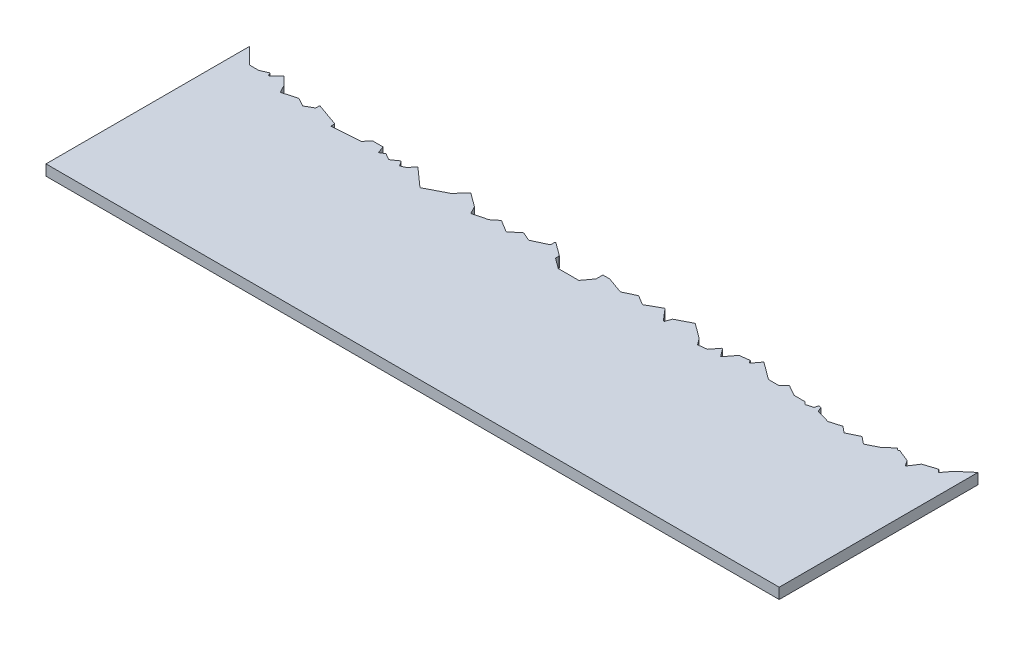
SolidWorks part; units mm, degrees
ref_plane "Plan de face" through (0, 0, 0) normal (0, 0, 1) x (1, 0, 0)
ref_plane "Plan de dessus" through (0, 0, 0) normal (0, 1, 0) x (1, 0, 0)
ref_plane "Plan de droite" through (0, 0, 0) normal (1, 0, 0) x (0, 0, -1)
sketch "Esquisse1" plane through (0, 0, 0) normal (0, 1, 0) x (1, 0, 0)
  line L0 (0, 380) -> (29.6078, 350.3922)
  line L1 (0, 0) -> (1380, 0)
  line L2 (0, 0) -> (0, 380)
  line L3 (30.3859, 350.0699) -> (47.204, 350.0699)
  line L4 (1380, 0) -> (1380, 380)
  line L5 (66.2029, 351.1725) -> (79.2872, 364.2568)
  line L6 (80.8434, 364.2568) -> (94.909, 350.1913)
  line L7 (95.109, 349.9173) -> (102.5748, 335.4306)
  line L8 (287.6719, 341.6175) -> (291.7608, 330.0833)
  line L9 (293.345, 329.4961) -> (300.7253, 333.7234)
  line L10 (161.514, 342.9881) -> (161.514, 348.511)
  line L11 (162.9829, 349.548) -> (204.2333, 334.8908)
  line L12 (204.9653, 333.8538) -> (204.9653, 328.0946)
  line L13 (206.1457, 326.997) -> (257.5216, 330.7384)
  line L14 (258.2637, 331.1044) -> (267.9444, 341.9814)
  line L15 (268.7664, 342.3503) -> (286.6347, 342.3503)
  line L16 (301.8089, 333.7292) -> (312.938, 327.5128)
  line L17 (314.1003, 327.5683) -> (326.2066, 335.9349)
  line L18 (342.3749, 330.9438) -> (351.7952, 341.5283)
  line L19 (353.3489, 341.6187) -> (365.5372, 330.7709)
  line L20 (365.5372, 330.7709) -> (387.3192, 311.3846)
  line L21 (388.5549, 311.2284) -> (426.2933, 330.6771)
  line L22 (426.6112, 330.9237) -> (442.9839, 349.3197)
  line L23 (444.4595, 349.4734) -> (456.7225, 340.4204)
  line L24 (456.7225, 340.4204) -> (469.5866, 330.9236)
  line L25 (469.9112, 330.5423) -> (476.7932, 317.1884)
  line L26 (744.2508, 329.6216) -> (766.414, 340.1649)
  line L27 (767.4591, 340.111) -> (784.4559, 329.7602)
  line L28 (785.5663, 329.7402) -> (811.2963, 344.1599)
  line L29 (812.6729, 343.9125) -> (824.9822, 329.4257)
  line L30 (602.2947, 341.1208) -> (602.2947, 347.8897)
  line L31 (604.0488, 348.775) -> (627.9897, 331.1008)
  line L32 (628.4366, 330.2154) -> (628.4366, 324.1417)
  line L33 (628.8834, 323.2564) -> (647.6092, 309.4322)
  line L34 (648.2628, 309.2171) -> (685.8402, 309.2171)
  line L35 (686.7256, 309.6639) -> (699.7849, 327.3537)
  line L36 (700, 328.0073) -> (700, 339.3199)
  line L37 (701.1004, 340.4204) -> (712.7067, 340.4204)
  line L38 (713.0752, 340.3569) -> (743.4096, 329.5784)
  line L39 (902.1623, 315.9772) -> (917.6508, 317.9743)
  line L40 (918.3813, 318.3935) -> (929.5593, 332.8809)
  line L41 (832.7537, 323.347) -> (836.4048, 333.6224)
  line L42 (836.9376, 334.2322) -> (863.9786, 348.1679)
  line L43 (865.1363, 348.075) -> (892.6776, 327.7428)
  line L44 (892.908, 327.5129) -> (901.1376, 316.4132)
  line L45 (1024.2055, 326.0327) -> (1043.2952, 326.0327)
  line L46 (1044.0733, 326.355) -> (1052.8484, 335.1301)
  line L47 (980.4641, 335.4146) -> (990.6296, 349.1846)
  line L48 (992.1686, 349.4163) -> (1013.0067, 334.0327)
  line L49 (1013.0067, 334.0327) -> (1023.5519, 326.2478)
  line L50 (1054.1696, 335.309) -> (1073.2496, 324.4831)
  line L51 (1073.7926, 324.3398) -> (1093.6981, 324.3398)
  line L53 (1121.8171, 321.1644) -> (1147.1468, 313.6935)
  line L54 (47.6431, 350.1613) -> (61.0963, 356.0161)
  line L55 (62.5293, 355.4794) -> (64.4309, 351.4783)
  line L56 (1147.7703, 313.6938) -> (1168.4316, 319.8059)
  line L57 (103.8529, 334.8759) -> (129.8044, 342.2261)
  line L58 (130.6409, 342.128) -> (145.5313, 333.8106)
  line L59 (1169.4352, 319.6067) -> (1180.3358, 310.8019)
  line L60 (1261.4801, 333.7148) -> (1284.1509, 324.5923)
  line L61 (1284.6558, 324.1816) -> (1290.7848, 314.9834)
  line L62 (1292.6193, 314.9879) -> (1303.7178, 331.8247)
  line L63 (1304.2987, 332.2663) -> (1327.5284, 339.7609)
  line L64 (1328.6968, 339.4355) -> (1332.4141, 335.1591)
  line L65 (1259.9808, 333.0723) -> (1260.184, 333.3474)
  line L68 (1334.13, 335.2275) -> (1345.0131, 349.9693)
  line L69 (1345.1822, 350.1512) -> (1380, 380)
  line L70 (146.6149, 333.8165) -> (160.9605, 342.0332)
  line L71 (327.7376, 335.6553) -> (333.2564, 327.6697)
  line L72 (334.6193, 327.2946) -> (342.0105, 330.6746)
  line L73 (478.054, 316.629) -> (504.0091, 323.5254)
  line L74 (504.4218, 323.736) -> (516.4467, 333.5366)
  line L75 (517.7225, 333.6184) -> (538.9932, 320.4083)
  line L76 (540.2691, 320.4901) -> (557.2893, 334.3622)
  line L77 (558.4326, 334.5143) -> (573.9539, 327.5964)
  line L78 (574.8677, 327.6046) -> (601.6601, 340.1238)
  line L79 (824.9822, 329.4257) -> (830.906, 322.9714)
  line L80 (931.3145, 332.864) -> (941.4444, 319.2013)
  line L81 (943.1996, 319.1845) -> (957.1005, 337.2008)
  line L82 (957.831, 337.62) -> (975.4217, 339.8882)
  line L83 (976.5262, 339.3278) -> (978.615, 335.5372)
  line L84 (1181.51, 310.669) -> (1202.7297, 321.0266)
  line L85 (1094.4763, 324.0175) -> (1098.2905, 320.2032)
  line L86 (1203.9039, 320.8937) -> (1216.3978, 310.8019)
  line L87 (1099.3808, 319.9261) -> (1111.17, 323.4136)
  line L88 (1111.9176, 324.1725) -> (1113.4005, 329.4764)
  line L89 (1114.7566, 330.2399) -> (1118.3693, 329.2299)
  line L90 (1119.1282, 328.4823) -> (1121.0731, 321.9078)
  line L91 (1217.572, 310.669) -> (1239.2738, 321.2619)
  line L92 (1239.5411, 321.4455) -> (1254.1736, 335.0719)
  line L93 (1255.6151, 335.1226) -> (1258.404, 332.8698)
  arc A0 (1345.0131, 349.9693) -> (1345.1822, 350.1512) centre (1345.8984, 349.3158) cw
  arc A1 (1332.4141, 335.1591) -> (1334.13, 335.2275) centre (1333.2447, 335.8811) ccw
  arc A2 (1327.5284, 339.7609) -> (1328.6968, 339.4355) centre (1327.8663, 338.7136) cw
  arc A3 (1303.7178, 331.8247) -> (1304.2987, 332.2663) centre (1304.6366, 331.219) cw
  arc A4 (1290.7848, 314.9834) -> (1292.6193, 314.9879) centre (1291.7006, 315.5936) ccw
  arc A5 (1284.1509, 324.5923) -> (1284.6558, 324.1816) centre (1283.7401, 323.5714) cw
  arc A6 (1260.184, 333.3474) -> (1261.4801, 333.7148) centre (1261.0693, 332.6939) cw
  arc A7 (1259.9808, 333.0723) -> (1258.404, 332.8698) centre (1259.0955, 333.7259) cw
  arc A8 (1254.1736, 335.0719) -> (1255.6151, 335.1226) centre (1254.9236, 334.2665) cw
  arc A9 (1239.2738, 321.2619) -> (1239.5411, 321.4455) centre (1238.7911, 322.2508) ccw
  arc A10 (1216.3978, 310.8019) -> (1217.572, 310.669) centre (1217.0893, 311.6579) ccw
  arc A11 (1202.7297, 321.0266) -> (1203.9039, 320.8937) centre (1203.2124, 320.0377) cw
  arc A12 (1180.3358, 310.8019) -> (1181.51, 310.669) centre (1181.0272, 311.6579) ccw
  arc A13 (1169.4352, 319.6067) -> (1168.4316, 319.8059) centre (1168.7438, 318.7506) ccw
  arc A14 (1147.1468, 313.6935) -> (1147.7703, 313.6938) centre (1147.4582, 314.749) ccw
  arc A15 (1121.8171, 321.1644) -> (1121.0731, 321.9078) centre (1122.1284, 322.2199) cw
  arc A16 (1118.3693, 329.2299) -> (1119.1282, 328.4823) centre (1118.073, 328.1701) cw
  arc A17 (1113.4005, 329.4764) -> (1114.7566, 330.2399) centre (1114.4603, 329.1801) cw
  arc A18 (1111.17, 323.4136) -> (1111.9176, 324.1725) centre (1110.8578, 324.4688) ccw
  arc A19 (1098.2905, 320.2032) -> (1099.3808, 319.9261) centre (1099.0687, 320.9813) ccw
  arc A20 (1093.6981, 324.3398) -> (1094.4763, 324.0175) centre (1093.6981, 323.2394) cw
  arc A21 (1073.2496, 324.4831) -> (1073.7926, 324.3398) centre (1073.7926, 325.4403) ccw
  arc A22 (1052.8484, 335.1301) -> (1054.1696, 335.309) centre (1053.6265, 334.3519) cw
  arc A23 (1043.2952, 326.0327) -> (1044.0733, 326.355) centre (1043.2952, 327.1331) ccw
  arc A24 (1024.2055, 326.0327) -> (1023.5519, 326.2478) centre (1024.2055, 327.1331) cw
  arc A25 (992.1686, 349.4163) -> (990.6296, 349.1846) centre (991.515, 348.531) ccw
  arc A26 (978.615, 335.5372) -> (980.4641, 335.4146) centre (979.5788, 336.0682) ccw
  arc A27 (975.4217, 339.8882) -> (976.5262, 339.3278) centre (975.5624, 338.7968) cw
  arc A28 (957.1005, 337.2008) -> (957.831, 337.62) centre (957.9717, 336.5286) cw
  arc A29 (929.5593, 332.8809) -> (931.3145, 332.864) centre (930.4305, 332.2086) cw
  arc A30 (941.4444, 319.2013) -> (943.1996, 319.1845) centre (942.3284, 319.8567) ccw
  arc A31 (917.6508, 317.9743) -> (918.3813, 318.3935) centre (917.51, 319.0657) ccw
  arc A32 (902.1623, 315.9772) -> (901.1376, 316.4132) centre (902.0216, 317.0686) cw
  arc A33 (892.908, 327.5129) -> (892.6776, 327.7428) centre (892.0241, 326.8575) ccw
  arc A34 (863.9786, 348.1679) -> (865.1363, 348.075) centre (864.4827, 347.1897) cw
  arc A35 (836.4048, 333.6224) -> (836.9376, 334.2322) centre (837.4417, 333.254) cw
  arc A36 (830.906, 322.9714) -> (832.7537, 323.347) centre (831.7168, 323.7155) ccw
  arc A37 (811.2963, 344.1599) -> (812.6729, 343.9125) centre (811.8343, 343.1999) cw
  arc A38 (784.4559, 329.7602) -> (785.5663, 329.7402) centre (785.0283, 330.7001) ccw
  arc A39 (766.414, 340.1649) -> (767.4591, 340.111) centre (766.8868, 339.1711) cw
  arc A40 (744.2508, 329.6216) -> (743.4096, 329.5784) centre (743.7781, 330.6153) cw
  arc A41 (712.7067, 340.4204) -> (713.0752, 340.3569) centre (712.7067, 339.3199) cw
  arc A42 (700, 339.3199) -> (701.1004, 340.4204) centre (701.1004, 339.3199) cw
  arc A43 (699.7849, 327.3537) -> (700, 328.0073) centre (698.8996, 328.0073) ccw
  arc A44 (685.8402, 309.2171) -> (686.7256, 309.6639) centre (685.8402, 310.3175) ccw
  arc A45 (647.6092, 309.4322) -> (648.2628, 309.2171) centre (648.2628, 310.3175) ccw
  arc A46 (628.4366, 324.1417) -> (628.8834, 323.2564) centre (629.537, 324.1417) ccw
  arc A47 (627.9897, 331.1008) -> (628.4366, 330.2154) centre (627.3361, 330.2154) cw
  arc A48 (602.2947, 347.8897) -> (604.0488, 348.775) centre (603.3952, 347.8897) cw
  arc A49 (601.6601, 340.1238) -> (602.2947, 341.1208) centre (601.1943, 341.1208) ccw
  arc A50 (573.9539, 327.5964) -> (574.8677, 327.6046) centre (574.4019, 328.6015) ccw
  arc A51 (557.2893, 334.3622) -> (558.4326, 334.5143) centre (557.9846, 333.5092) cw
  arc A52 (538.9932, 320.4083) -> (540.2691, 320.4901) centre (539.5738, 321.3431) ccw
  arc A53 (516.4467, 333.5366) -> (517.7225, 333.6184) centre (517.1419, 332.6836) cw
  arc A54 (504.0091, 323.5254) -> (504.4218, 323.736) centre (503.7265, 324.589) ccw
  arc A55 (478.054, 316.629) -> (476.7932, 317.1884) centre (477.7714, 317.6925) cw
  arc A56 (469.5866, 330.9236) -> (469.9112, 330.5423) centre (468.933, 330.0382) cw
  arc A57 (442.9839, 349.3197) -> (444.4595, 349.4734) centre (443.8059, 348.5881) cw
  arc A58 (426.2933, 330.6771) -> (426.6112, 330.9237) centre (425.7892, 331.6553) ccw
  arc A59 (387.3192, 311.3846) -> (388.5549, 311.2284) centre (388.0508, 312.2066) ccw
  arc A60 (351.7952, 341.5283) -> (353.3489, 341.6187) centre (352.6173, 340.7966) cw
  arc A61 (342.0105, 330.6746) -> (342.3749, 330.9438) centre (341.5528, 331.6754) ccw
  arc A62 (333.2564, 327.6697) -> (334.6193, 327.2946) centre (334.1617, 328.2953) ccw
  arc A63 (326.2066, 335.9349) -> (327.7376, 335.6553) centre (326.8323, 335.0296) cw
  arc A64 (312.938, 327.5128) -> (314.1003, 327.5683) centre (313.4746, 328.4735) ccw
  arc A65 (300.7253, 333.7234) -> (301.8089, 333.7292) centre (301.2723, 332.7685) cw
  arc A66 (291.7608, 330.0833) -> (293.345, 329.4961) centre (292.798, 330.451) ccw
  arc A67 (286.6347, 342.3503) -> (287.6719, 341.6175) centre (286.6347, 341.2498) cw
  arc A68 (267.9444, 341.9814) -> (268.7664, 342.3503) centre (268.7664, 341.2498) cw
  arc A69 (257.5216, 330.7384) -> (258.2637, 331.1044) centre (257.4416, 331.836) ccw
  arc A70 (204.9653, 328.0946) -> (206.1457, 326.997) centre (206.0658, 328.0946) ccw
  arc A71 (204.2333, 334.8908) -> (204.9653, 333.8538) centre (203.8649, 333.8538) cw
  arc A72 (161.514, 348.511) -> (162.9829, 349.548) centre (162.6144, 348.511) cw
  arc A73 (160.9605, 342.0332) -> (161.514, 342.9881) centre (160.4135, 342.9881) ccw
  arc A74 (145.5313, 333.8106) -> (146.6149, 333.8165) centre (146.068, 334.7714) ccw
  arc A75 (129.8044, 342.2261) -> (130.6409, 342.128) centre (130.1043, 341.1673) cw
  arc A76 (103.8529, 334.8759) -> (102.5748, 335.4306) centre (103.553, 335.9347) cw
  arc A77 (94.909, 350.1913) -> (95.109, 349.9173) centre (94.1308, 349.4132) cw
  arc A78 (79.2872, 364.2568) -> (80.8434, 364.2568) centre (80.0653, 363.4787) cw
  arc A79 (66.2029, 351.1725) -> (64.4309, 351.4783) centre (65.4248, 351.9507) cw
  arc A80 (61.0963, 356.0161) -> (62.5293, 355.4794) centre (61.5354, 355.0071) cw
  arc A81 (47.204, 350.0699) -> (47.6431, 350.1613) centre (47.204, 351.1703) ccw
  arc A82 (29.6078, 350.3922) -> (30.3859, 350.0699) centre (30.3859, 351.1703) ccw
  dimension "D3" = 1.1004
  dimension "D1" = 380
  dimension "D2" = 1380
  dimension "D4" = 380
extrude "Boss.-Extru.1" add sketch "Esquisse1" along normal mid plane 20
sketch "Esquisse2" plane through (0, 10, 0) normal (0, 1, 0) x (1, 0, 0)
  line L1 (1380, 0) -> (1370, 0)
  line L2 (1380, 0) -> (1380, 380)
  line L3 (1380, 380) -> (1370, 380)
  line L4 (1370, 0) -> (1370, 380)
  dimension "D1" = 10
extrude "Enlèv. mat.-Extru.1" cut sketch "Esquisse2" against normal up to next
